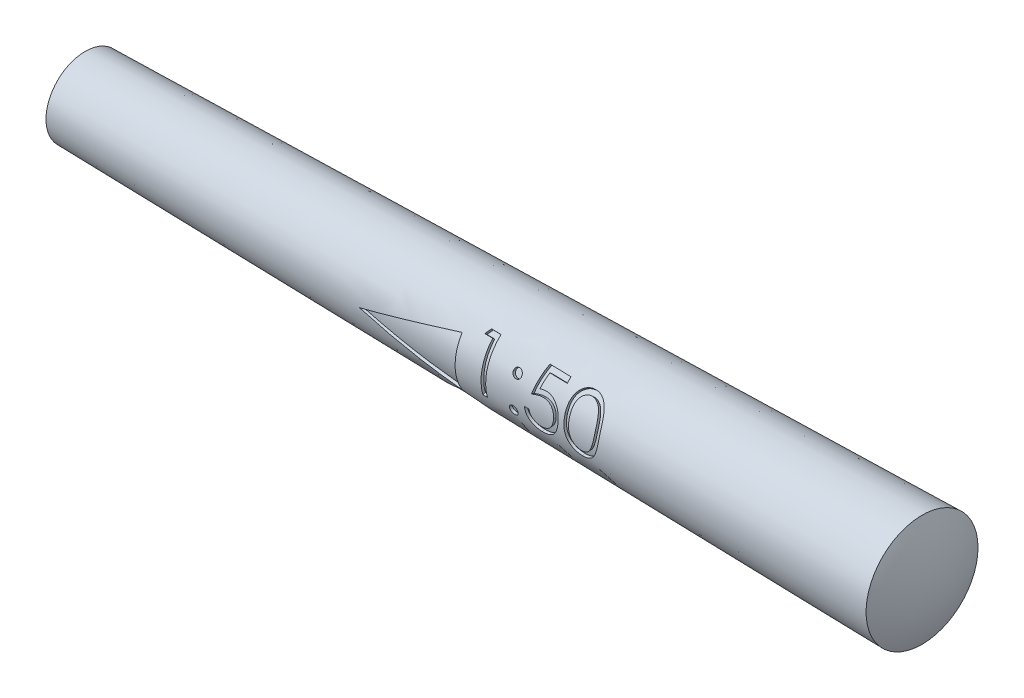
SolidWorks part; units mm, degrees
ref_plane "Front Plane" through (0, 0, 0) normal (0, 0, 1) x (1, 0, 0)
ref_plane "Top Plane" through (0, 0, 0) normal (0, 1, 0) x (1, 0, 0)
ref_plane "Right Plane" through (0, 0, 0) normal (1, 0, 0) x (0, 0, -1)
sketch "Sketch1" plane through (0, 0, 0) normal (1, 0, 0) x (0, 0, -1)
  circle A0 centre (0, 0) radius 0.75
  dimension "D1" = 1.5
extrude "Extrude1" add sketch "Sketch1" along normal mid plane 16
draft "Draft1" type of draft neutral plane draft angle 1.146 faces to draft 1 parameters "D1"=1.146
sketch "Sketch2" plane through (0, 0, 0) normal (0, 0, 1) x (1, 0, 0)
  line L0 (-8, 0) -> (-8, 0.75)
  line L1 (-8, 0.75) -> (-8, -0.75) construction
  line L2 (-8, 0) -> (-8.23, 0)
  line L3 (-8.23, 0) -> (-8.23, -0.91) construction
  line L4 (8, 0) -> (8, 1.07)
  line L5 (8, -1.07) -> (8, 1.07) construction
  line L6 (8, 0) -> (8.23, 0)
  line L7 (8.23, 0) -> (8.23, -0.91) construction
  line L8 (-8, -0.75) -> (8, -1.07) construction
  arc A0 (-8.23, 0) -> (-8, 0.75) centre (-6.8922, 0) cw
  arc A1 (8.23, 0) -> (8, 1.07) centre (5.626, 0) ccw
  point P14 (0, -0.91)
revolve "Revolve1" add sketch "Sketch2" angle 360 about L2
sketch "Sketch5" plane through (0, 0, 0) normal (0, 0, 1) x (1, 0, 0)
  line L0 (0, 0.91) -> (0, -0.91) construction
  line L1 (8, 1.07) -> (-8, 0.75) construction
  line L2 (-8, -0.75) -> (8, -1.07) construction
ref_plane "Plane2" through (0, 0, 0) normal (-0.02, 0, 0.9998) x (0.9998, 0, 0.02)
sketch "Sketch6" plane through (0, 0, 0) normal (-0.02, 0, 0.9998) x (0.9998, 0, 0.02)
  line L0 (0, 0) -> (0, 0.5)
  line L1 (0, 0.91) -> (0, -0.91) construction
  line L2 (0, 0.5) -> (-1.866, 0)
  line L3 (-1.866, 0) -> (0, -0.5)
  line L4 (0, -0.5) -> (0, 0)
  line L5 (0, -0.25) -> (3, -0.25) construction
  text T0 "1:50" font "Century Gothic" height 1
  dimension "D1" = 1
  dimension "D2" = 30
  dimension "D3" = 3
wrap "Wrap2" sketch "Sketch6" wrap type deboss source sketch "Sketch6" thickness 0.05 parameters "D1"=0.05
equation "\"D2@Sketch2\" = \"D1@Sketch2\""
